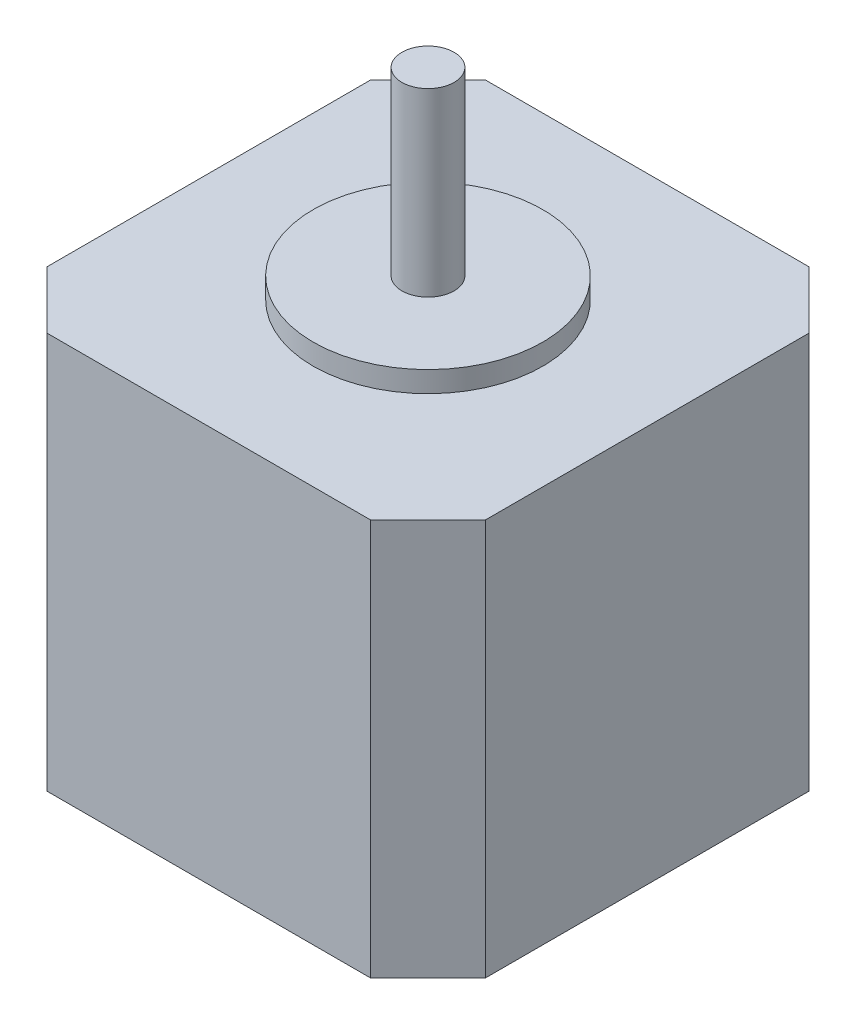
SolidWorks part; units mm, degrees
other "Body1"
ref_plane "Front" through (0, 0, 0) normal (0, 0, 1) x (1, 0, 0)
ref_plane "Top" through (0, 0, 0) normal (0, 1, 0) x (1, 0, 0)
ref_plane "Right" through (0, 0, 0) normal (1, 0, 0) x (0, 0, -1)
imported_body "Imported1"
hole_wizard "M3x0.5 Tapped Hole1" positions "Sketch2" profile "Sketch3" tap size "M3x0.5" standard "ANSI Metric"
sketch "Sketch2" plane through (0, 0, 0) normal (0, -1, 0) x (-1, 0, 0)
  line L1 (-15.494, 15.494) -> (15.494, 15.494) construction
  line L2 (-15.494, 15.494) -> (-15.494, -15.494) construction
  line L3 (-15.494, -15.494) -> (15.494, -15.494) construction
  line L4 (15.494, 15.494) -> (15.494, -15.494) construction
  line L5 (0, -15.494) -> (0, 15.494) construction
  line L6 (-15.494, 0) -> (15.494, 0) construction
  point P0 (15.494, -15.494)
  point P2 (-15.494, -15.494)
  point P4 (15.494, 15.494)
  point P6 (-15.494, 15.494)
  point P10 (0, 0)
  point P231 (-14.8303, -13.1285)
  point P232 (-14.8303, 13.1285)
  point P233 (14.8303, 13.1285)
  dimension "D1" = 30.988
sketch "Sketch3" plane through (-15.494, 0, 15.494) normal (1, 0, 0) x (0, 0, -1)
  line L0 (0, 0) -> (0, 8.2511)
  line L1 (0, 8.2511) -> (1.25, 7.5)
  line L2 (1.25, 7.5) -> (1.25, 0)
  line L5 (1.25, 0) -> (0, 0)
  line L10 (0, 8.2511) -> (-1.25, 7.5) construction
  line L11 (0, -6.35) -> (0, 107.95) construction
  dimension "Tap Drill Dia." = 2.5
  dimension "Tap Drill Depth" = 7.5
  dimension "Drill Angle" = 118
